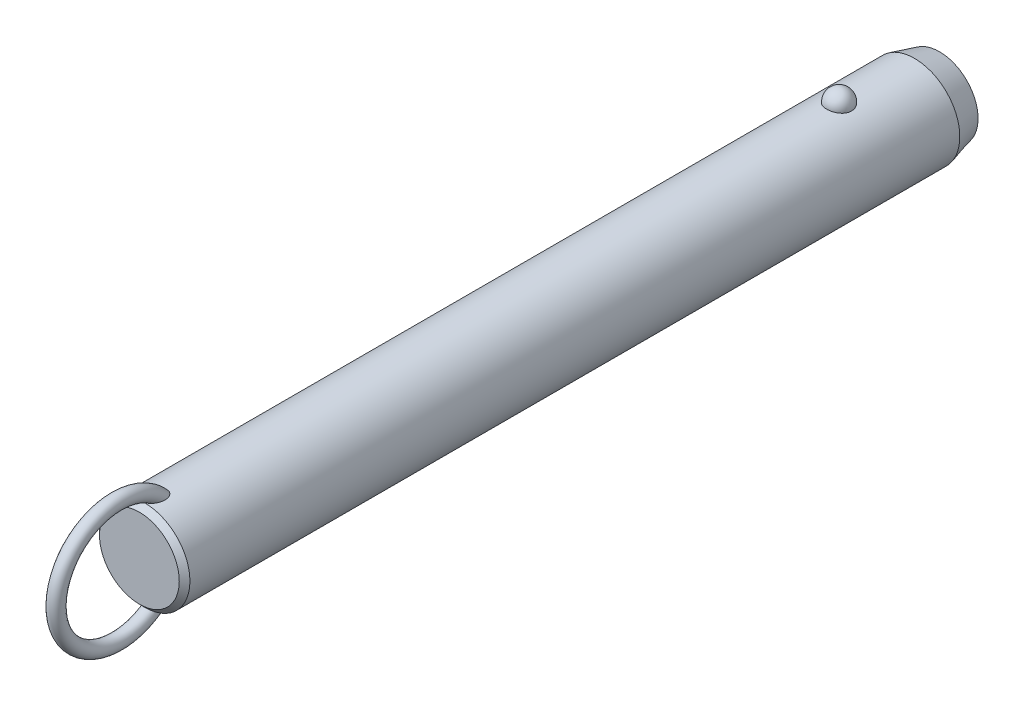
SolidWorks part; units mm, degrees
ref_plane "Front Plane" through (0, 0, 0) normal (0, 0, 1) x (1, 0, 0)
ref_plane "Top Plane" through (0, 0, 0) normal (0, 1, 0) x (1, 0, 0)
ref_plane "Right Plane" through (0, 0, 0) normal (1, 0, 0) x (0, 0, -1)
sketch "Sketch2" plane through (0, 0, 0) normal (0, 0, 1) x (1, 0, 0)
  circle A0 centre (0, 0) radius 12.7
  point P3 (0, 12.7)
  dimension "D1" = 25.4
extrude "Boss-Extrude1" add sketch "Sketch2" along normal blind 180.3
sketch "Sketch3" plane through (0, 0, 0) normal (0, 0, -1) x (-1, 0, 0)
  circle A0 centre (0, 0) radius 12.7
  dimension "D1" = 25.4
extrude "Boss-Extrude2" add sketch "Sketch3" along normal blind 31.7
chamfer "Chamfer1" distance 7 angle 15 1 edges at (-12.7, 0, -31.7)
sketch "Sketch12" plane through (0, 0, 0) normal (1, 0, 0) x (0, 0, -1)
  line L0 (-180.3, 12.7) -> (-180.3, -12.7) construction
  point P0 (-180.3, 0)
sketch "Sketch13" plane through (0, 0, 0) normal (1, 0, 0) x (0, 0, -1)
  circle A0 centre (-199.35, 0) radius 19.05
  point P2 (-180.3, 0)
  dimension "D1" = 38.1
sketch "Sketch14" plane through (0, 0, 0) normal (0, 1, 0) x (1, 0, 0)
  circle A0 centre (0, -182.3) radius 2
  point P2 (0, -180.3)
  dimension "D1" = 4
sweep "Sweep1" add profiles "Sketch14" path "Sketch13"
sketch "Sketch15" plane through (0, 0, 180.3) normal (0, 0, 1) x (1, 0, 0)
  circle A0 centre (0, 0) radius 12.7
  dimension "D1" = 25.4
extrude "Boss-Extrude3" add sketch "Sketch15" along normal blind 12.7
chamfer "Chamfer2" distance 1.5 angle 45 1 edges at (12.7, 0, 193)
sketch "Sketch18" plane through (0, 0, 0) normal (1, 0, 0) x (0, 0, -1)
  line L0 (24.7, 12.7) -> (-185.151, 12.7) construction
  line L1 (3.5, 16.2) -> (3.5, 9.2)
  line L2 (-185.151, -12.7) -> (24.7, -12.7) construction
  arc A0 (3.5, 16.2) -> (3.5, 9.2) centre (3.5, 12.7) ccw
  point P4 (0, 12.7)
  dimension "D1" = 28.9
revolve "Revolve1" add sketch "Sketch18" angle 360 about L1
